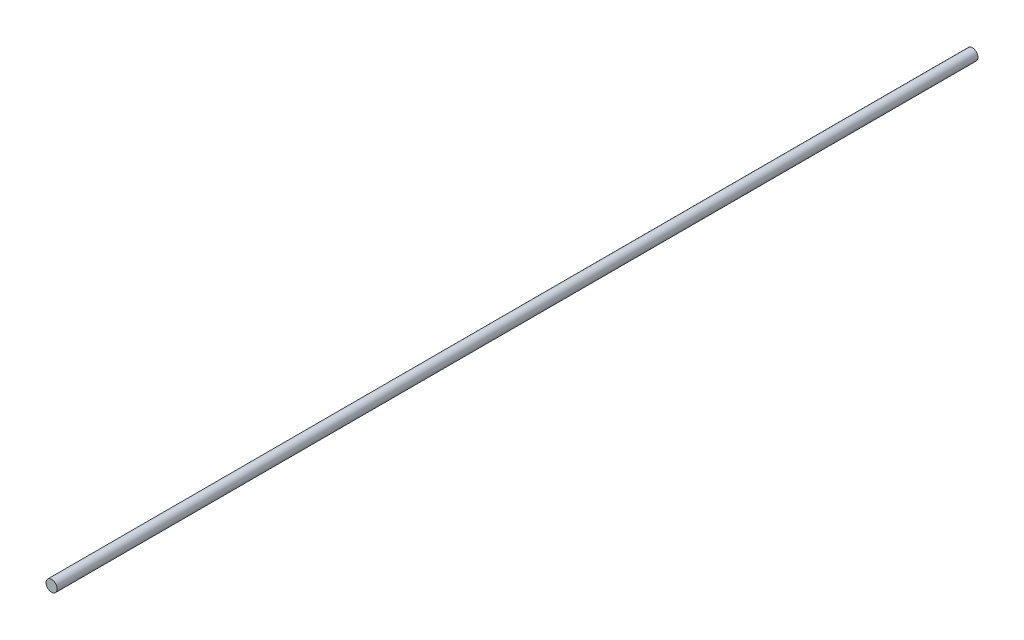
SolidWorks part; units mm, degrees
ref_plane "Front Plane" through (0, 0, 0) normal (0, 0, 1) x (1, 0, 0)
ref_plane "Top Plane" through (0, 0, 0) normal (0, 1, 0) x (1, 0, 0)
ref_plane "Right Plane" through (0, 0, 0) normal (1, 0, 0) x (0, 0, -1)
sketch "Sketch1" plane through (0, 0, 0) normal (0, 0, 1) x (1, 0, 0)
  circle A0 centre (0, 0) radius 30
  dimension "D1" = 60
extrude "Boss-Extrude1" add sketch "Sketch1" against normal blind 4950
